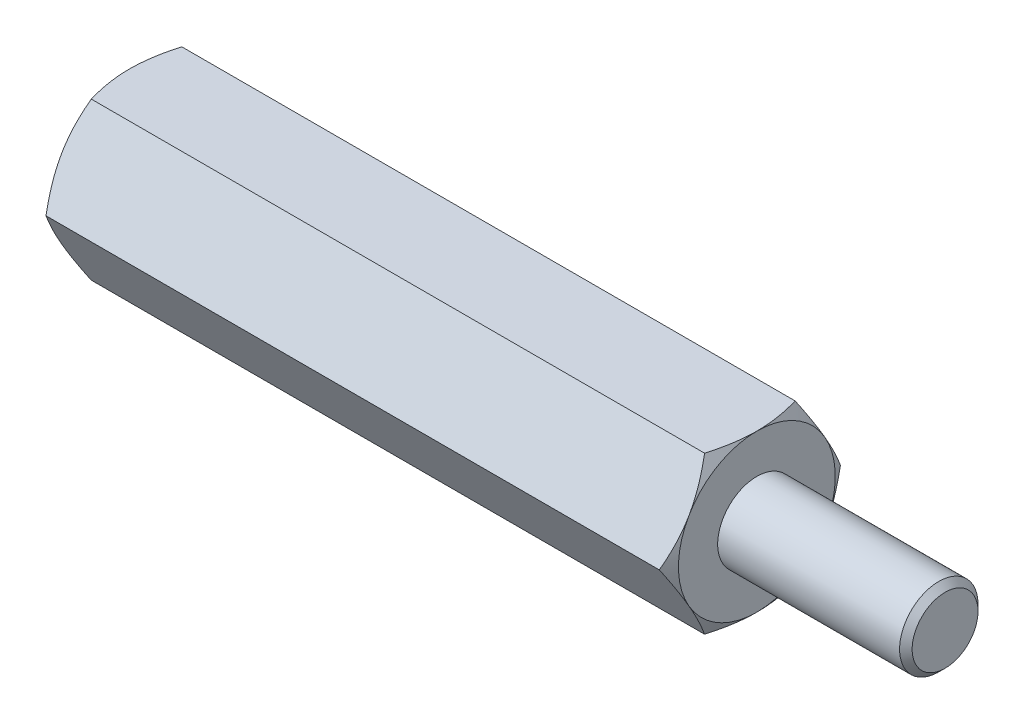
SolidWorks part; units mm, degrees
ref_plane "Front Plane" through (0, 0, 0) normal (0, 0, 1) x (1, 0, 0)
ref_plane "Top Plane" through (0, 0, 0) normal (0, 1, 0) x (1, 0, 0)
ref_plane "Right Plane" through (0, 0, 0) normal (1, 0, 0) x (0, 0, -1)
sketch "Sketch1" plane through (0, 0, 0) normal (1, 0, 0) x (0, 0, -1)
  line L1 (1.4434, 2.5) -> (-1.4434, 2.5)
  line L2 (-1.4434, 2.5) -> (-2.8868, 0)
  line L3 (-2.8868, 0) -> (-1.4434, -2.5)
  line L4 (-1.4434, -2.5) -> (1.4434, -2.5)
  line L5 (1.4434, -2.5) -> (2.8868, 0)
  line L6 (2.8868, 0) -> (1.4434, 2.5)
  circle A0 centre (0, 0) radius 2.5 construction
  dimension "D1" = 5
extrude "Extrude2" add sketch "Sketch1" along normal mid plane 20
sketch "Sketch2" plane through (0, 0, 0) normal (0, 0, 1) x (1, 0, 0)
  line L0 (-10, 2.5) -> (-8.5, 5.0981)
  line L1 (-10, 5.5) -> (-10, 2.5)
  line L3 (0, 0) -> (50000, 0) construction
  arc A0 (-8.5, 5.0981) -> (-10, 5.5) centre (-9.1962, 5.5) ccw
  dimension "D1" = 30
  dimension "D2" = 3
revolve "Cut-Revolve1" cut sketch "Sketch2" angle 360 about L3
mirror "Mirror1" about plane through (0, 0, 0) normal (1, 0, 0) of "Cut-Revolve1"
sketch "Sketch3" plane through (-10, 0, 0) normal (-1, 0, 0) x (0, 0, 1)
  circle A0 centre (0, 0) radius 1.05
  dimension "D1" = 2.1
extrude "Extrude3" cut sketch "Sketch3" against normal blind 6
sketch "Sketch4" plane through (0, 0, 0) normal (0, 0, 1) x (1, 0, 0)
  line L0 (-4, 0) -> (-4, 1.05)
  line L1 (9.7767, 0) -> (-9.7767, 0) construction
  line L2 (-4, 1.05) -> (-3.3938, 0)
  line L3 (-3.3938, 0) -> (-4, 0)
  line L4 (-10, 1.25) -> (-10, -1.25) construction
  point P4 (-10, 0)
  dimension "D1" = 30
  dimension "D2" = 1.05
  dimension "D3" = 6
revolve "Cut-Revolve2" cut sketch "Sketch4" angle 360 about L3
sketch "Sketch5" plane through (10, 0, 0) normal (1, 0, 0) x (0, 0, -1)
  circle A0 centre (0, 0) radius 1.25
  dimension "D1" = 2.5
extrude "Extrude4" add sketch "Sketch5" along normal blind 6
chamfer "Chamfer1" distance 0.2 angle 45 1 edges at (16, 0, -1.25)
equation "\"D2@Sketch4\" = \"D1@Sketch3\"/2"
